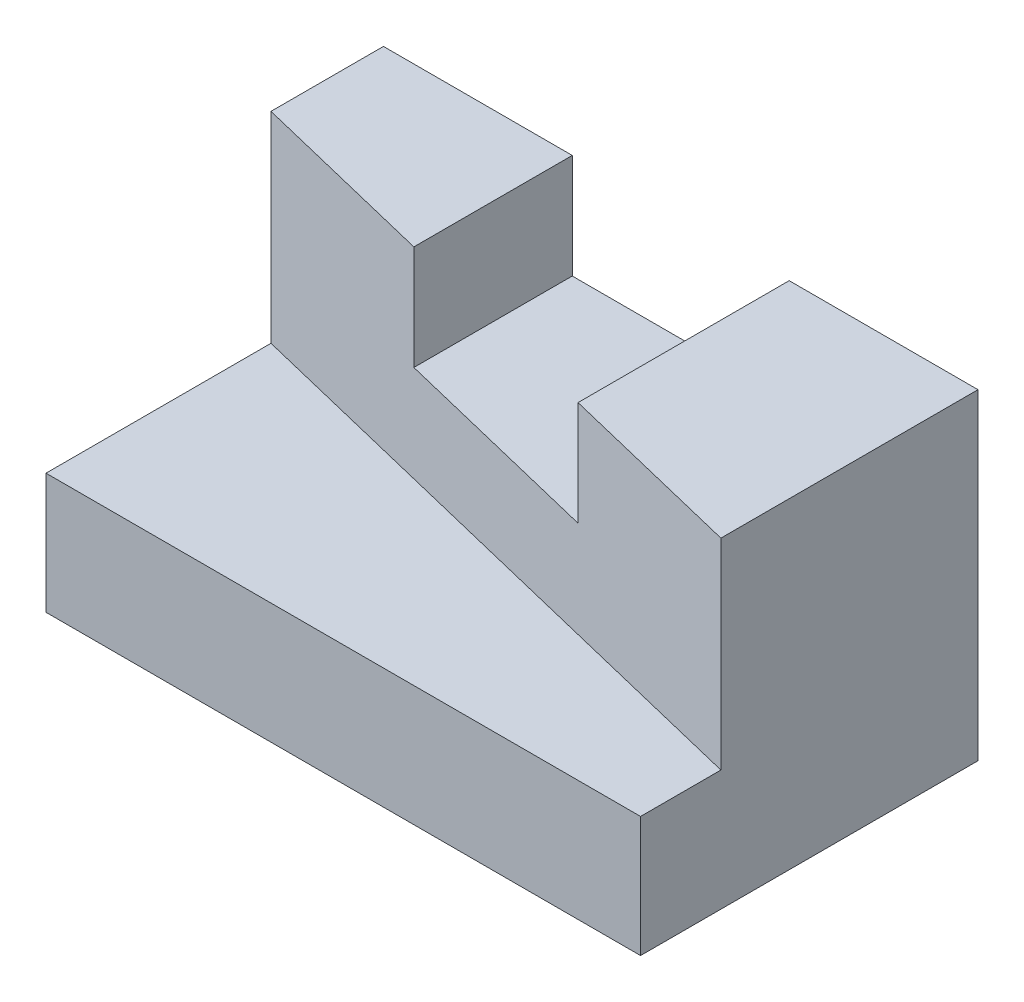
SolidWorks part; units mm, degrees
ref_plane "前视基准面" through (0, 0, 0) normal (0, 0, 1) x (1, 0, 0)
ref_plane "上视基准面" through (0, 0, 0) normal (0, 1, 0) x (1, 0, 0)
ref_plane "右视基准面" through (0, 0, 0) normal (1, 0, 0) x (0, 0, -1)
sketch "草图2" plane through (0, 0, 0) normal (0, 0, 1) x (1, 0, 0)
  line L0 (0, 0) -> (0, 7) construction
  line L1 (0, 85.9075) -> (0, 0) construction
  line L2 (0, 0) -> (96.7463, 0) construction
  line L3 (13.5, 20) -> (13.5, 7)
  line L4 (-37, 20) -> (-13.5, 20)
  line L5 (-37, 20) -> (-37, -20)
  line L6 (-37, -20) -> (37, -20)
  line L7 (37, 20) -> (37, -20)
  line L8 (13.5, 7) -> (-13.5, 7)
  line L9 (-13.5, 7) -> (-13.5, 20)
  line L10 (13.5, 20) -> (37, 20)
  dimension "D1" = 74
  dimension "D2" = 40
  dimension "D3" = 27
  dimension "D4" = 13
extrude "拉伸1" add sketch "草图2" along normal blind 42
sketch "草图3" plane through (0, 20, 0) normal (0, 1, 0) x (1, 0, 0)
  line L0 (37, -32) -> (37, -42)
  line L1 (37, -42) -> (37, 0) construction
  line L2 (37, -42) -> (-37, -42)
  line L3 (-37, -42) -> (-37, -14)
  line L4 (-37, -42) -> (-37, 0) construction
  line L5 (-37, -14) -> (37, -32)
extrude "切除-拉伸1" cut sketch "草图3" against normal blind 25
